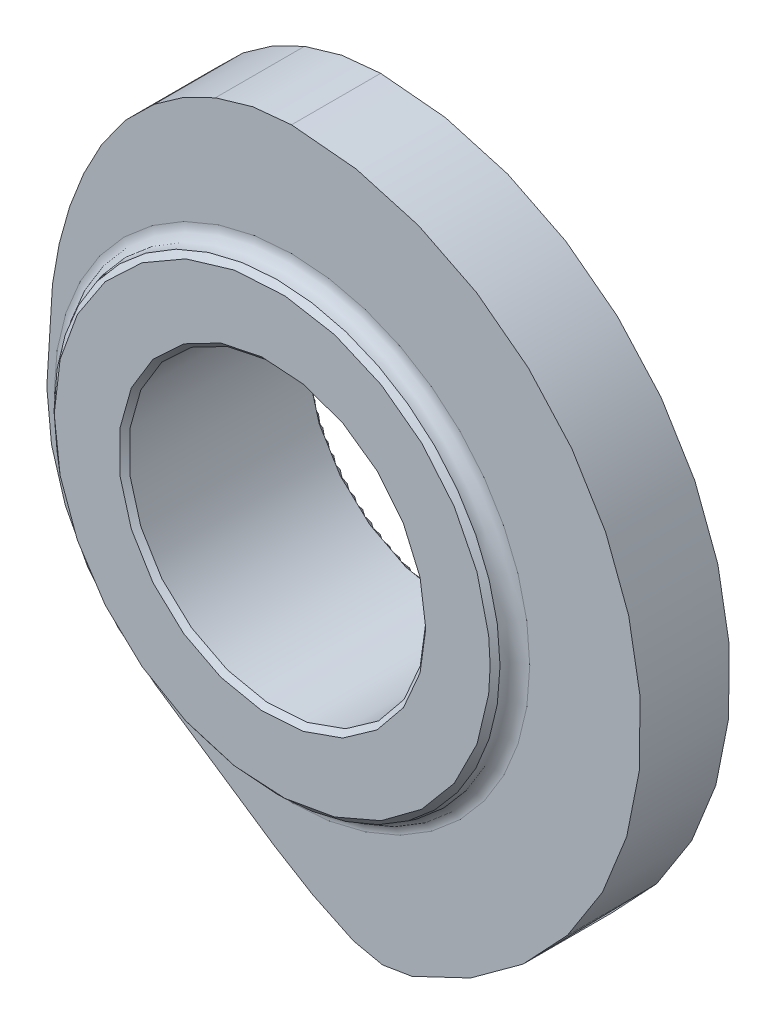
SolidWorks part; units mm, degrees
ref_plane "Piano frontale" through (0, 0, 0) normal (0, 0, 1) x (1, 0, 0)
ref_plane "Piano superiore" through (0, 0, 0) normal (0, 1, 0) x (1, 0, 0)
ref_plane "Piano destro" through (0, 0, 0) normal (1, 0, 0) x (0, 0, -1)
sketch "Schizzo1" plane through (0, 0, 0) normal (0, 0, 1) x (1, 0, 0)
  line L1 (0, 0) -> (139.63, 0) construction
  line L2 (0, 0) -> (-139.63, 0) construction
  line L22 (-0.1407, 96.5) -> (0, 0) construction
  line L30 (-27.6542, -41.0548) -> (-3.6229, -57.2421)
  arc A2 (24.209, -66.2131) -> (12.3894, -65.9185) centre (18.6729, -51.0716) cw
  arc A3 (-49.5, 0) -> (-48.3513, 18.5223) centre (100.4016, 0) cw
  arc A4 (12.3894, -65.9185) -> (-3.6229, -57.2421) centre (49.3352, 21.3783) cw
  arc A8 (-48.3513, 18.5223) -> (-44.8918, 33.7972) centre (30.3947, 8.7171) cw
  arc A10 (24.209, -66.2131) -> (-0.1028, 70.4999) centre (0, 0) ccw
  arc A12 (-49.5, 0) -> (-27.6542, -41.0548) centre (0, 0) ccw
  arc A13 (-44.8918, 33.7972) -> (-38.4284, 47.8838) centre (22.9339, 11.2025) cw
  arc A17 (-38.4284, 47.8838) -> (-27.8569, 60.2004) centre (2.6236, 23.3437) cw
  arc A18 (-27.8569, 60.2004) -> (-15.474, 67.5396) centre (1.672, 24.4943) cw
  arc A22 (-15.474, 67.5396) -> (-0.1028, 70.4999) centre (-0.042, 28.7973) cw
  dimension "D1" = 49.5
  dimension "D2" = 70.5
  dimension "D3" = 16.1218
  dimension "D4" = 94.7931
  dimension "D5" = 1.672
  dimension "D6" = 2.6236
  dimension "D7" = 149.9016
  dimension "D8" = 79.354
  dimension "D10" = 12.3894
  dimension "D11" = 18.6729
  dimension "D12" = 22.9339
  dimension "D9" = 89.916
  dimension "D15" = 71.4902
  dimension "D16" = 47.8276
  dimension "D17" = 46.3345
  dimension "D18" = 41.7027
extrude "Estrusione1" add sketch "Schizzo1" along normal mid plane 18
sketch "Schizzo2" plane through (0, 0, 9) normal (0, 0, 1) x (1, 0, 0)
  circle A0 centre (0, 0) radius 45
  dimension "D1" = 90
ref_plane "Piano1" through (0, 45, 0) normal (0, 1, 0) x (-1, 0, 0)
sketch "Schizzo8" plane through (0, 0, -9) normal (0, 0, -1) x (-1, 0, 0)
  circle A2 centre (0, 0) radius 45
  dimension "D1" = 90
extrude "Estrusione5" add sketch "Schizzo2" along normal blind 4
extrude "Estrusione6" add sketch "Schizzo8" along normal blind 15
sketch "Schizzo10" plane through (0, 0, -24) normal (0, 0, -1) x (-1, 0, 0)
  circle A0 centre (0, 0) radius 30
  dimension "D1" = 60
extrude "Taglio-Estrusione2" cut sketch "Schizzo10" against normal up to next
fillet "Raccordo1" radius 3 2 edges at (-45, 0, 9) (-45, 0, -9)
sketch "Schizzo13" plane through (0, 0, -24) normal (0, 0, 1) x (1, 0, 0)
  line L0 (-1.396, 29.9675) -> (-1.9195, 44.959)
  line L1 (1.396, 29.9675) -> (1.9195, 44.959)
  line L2 (0, 0) -> (0, 19.0454) construction
  circle A0 centre (0, 0) radius 45 construction
  arc A1 (1.396, 29.9675) -> (-1.396, 29.9675) centre (0, 0) ccw
  arc A4 (1.9195, 44.959) -> (-1.9195, 44.959) centre (0, 0) ccw
  dimension "D3" = 30
  dimension "D1" = 4
  dimension "D2" = 2
  dimension "D4" = 1.396
extrude "Estrusione8" add sketch "Schizzo13" against normal blind 23 draft 44
pattern_circular "RipetizioneCircolare3" count 90 over 360 about axis through (0, 0, 0) along (0, 0, 1) of "Estrusione8"
chamfer "Smusso1" distance 1 angle 45 2 edges at (30, 0, 13) (45, 0, 13)
hole_wizard "M8.0 (8.000000) Foro diametrale1" positions "Schizzo15" profile "Schizzo14" hole size "M8.0" standard "ISO"
sketch "Schizzo15" plane through (0, 45, 0) normal (0, 1, 0) x (-1, 0, 0)
  point P0 (0, -17)
  dimension "D1" = 17
sketch "Schizzo14" plane through (0, 45, -17) normal (1, 0, 0) x (0, 0, 1)
  line L0 (0, 0) -> (0, 12.4034)
  line L1 (0, 12.4034) -> (4, 10)
  line L2 (4, 10) -> (4, 0)
  line L5 (4, 0) -> (0, 0)
  line L10 (0, 12.4034) -> (-4, 10) construction
  line L11 (0, -6.35) -> (0, 107.95) construction
  dimension "Hole Dia." = 8
  dimension "Hole Depth" = 10
  dimension "Drill Angle" = 118
pattern_circular "RipetizioneCircolare4" count 6 over 360 about axis through (0, 0, -24) along (0, 0, 1) of "M8.0 (8.000000) Foro diametrale1"
sketch "Cam Contour" plane through (0, 0, 0) normal (0, 0, 1) x (1, 0, 0)
  line L1 (-27.6542, -41.0548) -> (-3.6229, -57.2421)
  line L2 (-27.6542, -41.0548) -> (-3.6229, -57.2421)
  arc A10 (-0.1028, 70.4999) -> (-15.474, 67.5396) centre (-0.042, 28.7973) ccw
  arc A11 (-15.474, 67.5396) -> (-27.8569, 60.2004) centre (1.672, 24.4943) ccw
  arc A12 (-27.8569, 60.2004) -> (-38.4284, 47.8838) centre (2.6236, 23.3437) ccw
  arc A13 (-38.4284, 47.8838) -> (-44.8918, 33.7972) centre (22.9339, 11.2025) ccw
  arc A14 (-44.8918, 33.7972) -> (-48.3513, 18.5223) centre (30.3947, 8.7171) ccw
  arc A15 (-48.3513, 18.5223) -> (-49.5, 0) centre (100.4016, 0) ccw
  arc A16 (-49.5, 0) -> (-27.6542, -41.0548) centre (0, 0) ccw
  arc A17 (-3.6229, -57.2421) -> (12.3894, -65.9185) centre (49.3352, 21.3783) ccw
  arc A18 (12.3894, -65.9185) -> (24.209, -66.2131) centre (18.6729, -51.0716) ccw
  arc A19 (24.209, -66.2131) -> (-0.1028, 70.4999) centre (0, 0) ccw
  arc A20 (-0.1028, 70.4999) -> (-15.474, 67.5396) centre (-0.042, 28.7973) ccw
  arc A21 (-15.474, 67.5396) -> (-27.8569, 60.2004) centre (1.672, 24.4943) ccw
  arc A22 (-27.8569, 60.2004) -> (-38.4284, 47.8838) centre (2.6236, 23.3437) ccw
  arc A23 (-38.4284, 47.8838) -> (-44.8918, 33.7972) centre (22.9339, 11.2025) ccw
  arc A24 (-44.8918, 33.7972) -> (-48.3513, 18.5223) centre (30.3947, 8.7171) ccw
  arc A25 (-48.3513, 18.5223) -> (-49.5, 0) centre (100.4016, 0) ccw
  arc A26 (-49.5, 0) -> (-27.6542, -41.0548) centre (0, 0) ccw
  arc A27 (-3.6229, -57.2421) -> (12.3894, -65.9185) centre (49.3352, 21.3783) ccw
  arc A28 (12.3894, -65.9185) -> (24.209, -66.2131) centre (18.6729, -51.0716) ccw
  arc A29 (24.209, -66.2131) -> (-0.1028, 70.4999) centre (0, 0) ccw
  dimension "D1" = 0
